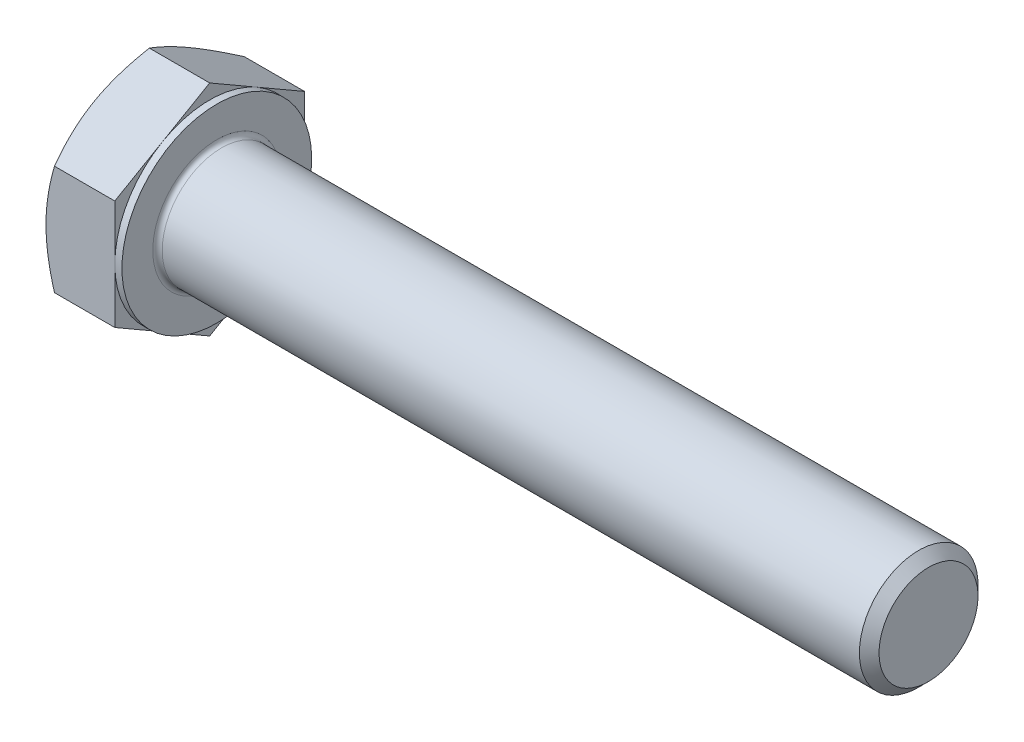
SolidWorks part; units mm, degrees
ref_plane "Plane1" through (0, 0, 0) normal (0, 0, 1) x (1, 0, 0)
ref_plane "Plane2" through (0, 0, 0) normal (0, 1, 0) x (1, 0, 0)
ref_plane "Plane3" through (0, 0, 0) normal (1, 0, 0) x (0, 0, -1)
sketch "Sketch1" plane through (0, 0, 0) normal (1, 0, 0) x (0, 0, -1)
  line L0 (8, 4.6188) -> (8, -4.6188)
  line L1 (-8, 4.6188) -> (-8, -4.6188)
  line L2 (8, -4.6188) -> (0, -9.2376)
  line L3 (0, -9.2376) -> (-8, -4.6188)
  line L4 (8, 4.6188) -> (0, 9.2376)
  line L5 (0, 9.2376) -> (-8, 4.6188)
  dimension "Width_flats" = 16
  dimension "D2" = 120
  dimension "D3" = 8
  dimension "D4" = 8
  dimension "D5" = 8
extrude "BaseHead" add sketch "Sketch1" along normal blind 6.4
sketch "BodySke" plane through (0, 0, 0) normal (0, 0, 1) x (1, 0, 0)
  line L0 (0, 4.6188) -> (0, -4.6188) construction
  line L1 (0, 0) -> (66.4, 0)
  line L2 (0, 0) -> (0, 5)
  line L3 (0, 5) -> (65.572, 5)
  line L4 (66.4, 0) -> (66.4, 4.172)
  line L5 (6.4, 9.2376) -> (6.4, 4.6188) construction
  line L6 (66.4, 4.172) -> (65.572, 5)
  line L7 (0, 0) -> (96.52, 0) construction
  line L8 (66.4, -4.172) -> (65.572, -5) construction
  line L9 (0, -5) -> (65.572, -5) construction
  line L10 (7.9, 15.24) -> (7.9, -1.27) construction
  line L11 (40.4, 15.24) -> (40.4, -1.27) construction
  line L12 (6.4, 4.6188) -> (6.4, -4.6188) construction
  dimension "Length" = 60
  dimension "Body_ch_ang" = 45
  dimension "Diameter" = 10
  dimension "Minor_dia" = 8.344
  dimension "Advance" = 1.5
  dimension "Thread_nom" = 26
revolve "BaseBody" add sketch "BodySke"
fillet "HeadFillet" radius 0.4 1 edges at (6.4, 0, -5)
sketch "Sketch3" plane through (0, 0, 0) normal (0, 0, 1) x (1, 0, 0)
  line L0 (0, 8) -> (3.6013, 14.2376)
  line L1 (0, 9.2376) -> (0, 4.6188) construction
  line L2 (3.6013, 14.2376) -> (3.6013, 19.2376)
  line L3 (3.6013, 19.2376) -> (-10, 19.2376)
  line L4 (-10, 19.2376) -> (-10, 8)
  line L5 (-10, 8) -> (0, 8)
  line L6 (0, 0) -> (99.06, 0) construction
  line L7 (6.4, 9.2376) -> (0, 9.2376) construction
  dimension "D1" = 8
  dimension "D2" = 5
  dimension "D3" = 10
  dimension "D4" = 5
  dimension "Head_ch_ang" = 30
revolve "HeadChamfer" cut sketch "Sketch3" angle 360 about L6
sketch "Sketch4" plane through (0, 0, 0) normal (0, 0, 1) x (1, 0, 0)
  line L1 (6.4, 9.2376) -> (6.4, 4.6188) construction
  line L2 (6.4, 8) -> (5.8, 8)
  line L3 (6.4, 8) -> (6.4, 19.2376)
  line L4 (6.4, 19.2376) -> (5.8, 19.2376)
  line L5 (0, 0) -> (95.25, 0) construction
  line L6 (0, 0) -> (96.52, 0) construction
  line L7 (5.8, 8) -> (5.8, 19.2376)
  line L8 (6.4, 9.2376) -> (0.7145, 9.2376) construction
  dimension "D1" = 16
  dimension "D2" = 10
  dimension "Bearing_ht" = 0.6
revolve "BearingFace" cut sketch "Sketch4" angle 360 about L5
sketch "ThdSchSke" plane through (0, 0, 0) normal (0, 0, 1) x (1, 0, 0)
  line L0 (40.4, -4.172) -> (39.8202, -5)
  line L1 (40.4, -4.172) -> (40.9798, -5)
  line L2 (40.9798, -5) -> (40.9798, -6.25)
  line L3 (-3.175, 0) -> (5.1513, 0) construction
  line L5 (40.9798, -6.25) -> (39.8202, -6.25)
  line L6 (39.8202, -6.25) -> (39.8202, -5)
  dimension "Thread_minor" = 8.344
  dimension "Diameter" = 10
  dimension "Start" = 40.4
  dimension "SideAngle" = 55
  dimension "VeeAngle" = 70
  dimension "Overcut" = 12.5
revolve "ThreadSchematic" [suppressed] cut sketch "ThdSchSke" angle 360 about L3
pattern_linear "ThdSchPat" [suppressed]
equation "\"D3@Sketch1\" = \"Width_flats@Sketch1\" / 2"
equation "\"D4@Sketch1\" = \"D3@Sketch1\""
equation "\"D5@Sketch1\" = \"D4@Sketch1\""
equation "\"Thread_minor@ThreadCosmetic\" = \"Minor_dia@BodySke\""
equation "\"D1@Sketch3\" = \"Width_flats@Sketch1\" / 2"
equation "\"D1@Sketch4\" = \"Width_flats@Sketch1\""
equation "\"Thread_length@ThreadCosmetic\" = ((sgn( (\"Length@BodySke\" - \"Advance@BodySke\" ) - \"Thread_nom@BodySke\" )-1)*( (\"Length@BodySke\" - \"Advance@BodySke\" ) - \"Thread_nom@BodySke\" ))/-2+ \"Thread_nom@BodySke\""
equation "\"Thread_minor@ThdSchSke\" = \"Minor_dia@BodySke\""
equation "\"Diameter@ThdSchSke\" = \"Diameter@BodySke\""
equation "\"Overcut@ThdSchSke\" = \"Diameter@BodySke\" * 1.25"
equation "\"Start@ThdSchSke\" = \"Head_ht@BaseHead\" + \"Length@BodySke\" - \"Thread_length@ThreadCosmetic\"  '---Non-countersunk---"
equation "\"Num_threads@ThdSchPat\" = int( \"Thread_length@ThreadCosmetic\" / \"Advance@BodySke\" + 0.999 )  + 1"
equation "\"Advance@ThdSchPat\" = \"Thread_length@ThreadCosmetic\" /  (\"Num_threads@ThdSchPat\" - 1) 'relax it"
equation "\"Num_threads@ThdSchPat\" = \"Num_threads@ThdSchPat\" - sgn( \"Num_threads@ThdSchPat\" - 1) '---chamfered tips only---"
